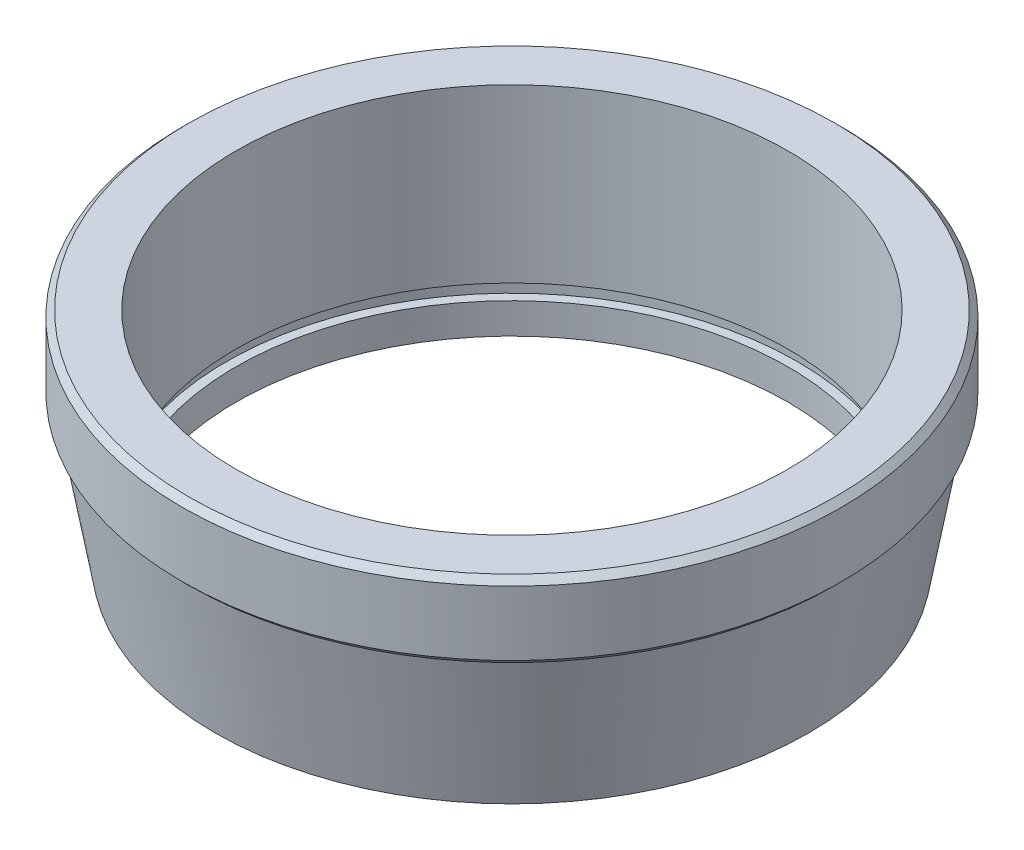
SolidWorks part; units mm, degrees
ref_plane "Přední rovina" through (0, 0, 0) normal (0, 0, 1) x (1, 0, 0)
ref_plane "Horní rovina" through (0, 0, 0) normal (0, 1, 0) x (1, 0, 0)
ref_plane "Pravá rovina" through (0, 0, 0) normal (1, 0, 0) x (0, 0, -1)
sketch "Skica1" plane through (0, 0, 0) normal (0, 1, 0) x (1, 0, 0)
  circle A0 centre (0, 0) radius 10.5
extrude "Přidat vysunutím1" add sketch "Skica1" against normal blind 4.6 draft 10
sketch "Skica2" plane through (0, 0, 0) normal (0, 1, 0) x (-1, 0, 0)
  circle A0 centre (0, 0) radius 10.75
extrude "Přidat vysunutím2" add sketch "Skica2" along normal blind 2.5
chamfer "Zkosení1" distance 0.2 angle 45 2 edges at (0, 0, 10.75) (0, 2.5, 10.75)
sketch "Skica3" plane through (0, 2.5, 0) normal (0, 1, 0) x (1, 0, 0)
  circle A0 centre (0, 0) radius 9
extrude "Odebrat vysunutím1" cut sketch "Skica3" against normal blind 2.5
sketch "Skica4" plane through (0, -4.6, 0) normal (0, -1, 0) x (1, 0, 0)
  circle A0 centre (0, 0) radius 9
extrude "Odebrat vysunutím2" cut sketch "Skica4" against normal up to surface (4.6 mm away)
sketch "Skica5" plane through (0, 0, 0) normal (0, 0, 1) x (1, 0, 0)
  line L0 (-9.6889, -4.6) -> (9.6889, -4.6) construction
  line L1 (-9.3, -3.6) -> (-9, -3.6)
  line L2 (-9.3, -3.6) -> (-9.3, -3.1)
  line L3 (-9.3, -3.1) -> (-9, -3.1)
  line L4 (-9, -3.6) -> (-9, -3.1)
  line L5 (-9, -4.6) -> (9, -4.6) construction
  point P8 (-3.25, -4.6)
  dimension "D1" = 0.3
  dimension "D2" = 0.5
  dimension "D3" = 1
  dimension "D5" = 9.3
ref_axis "Osa1" through (0, 2.5, 0) along (0, -1, 0)
revolve "Odebrat rotací1" cut sketch "Skica5" angle 360 about axis through (0, 2.5, 0) along (0, -1, 0)
